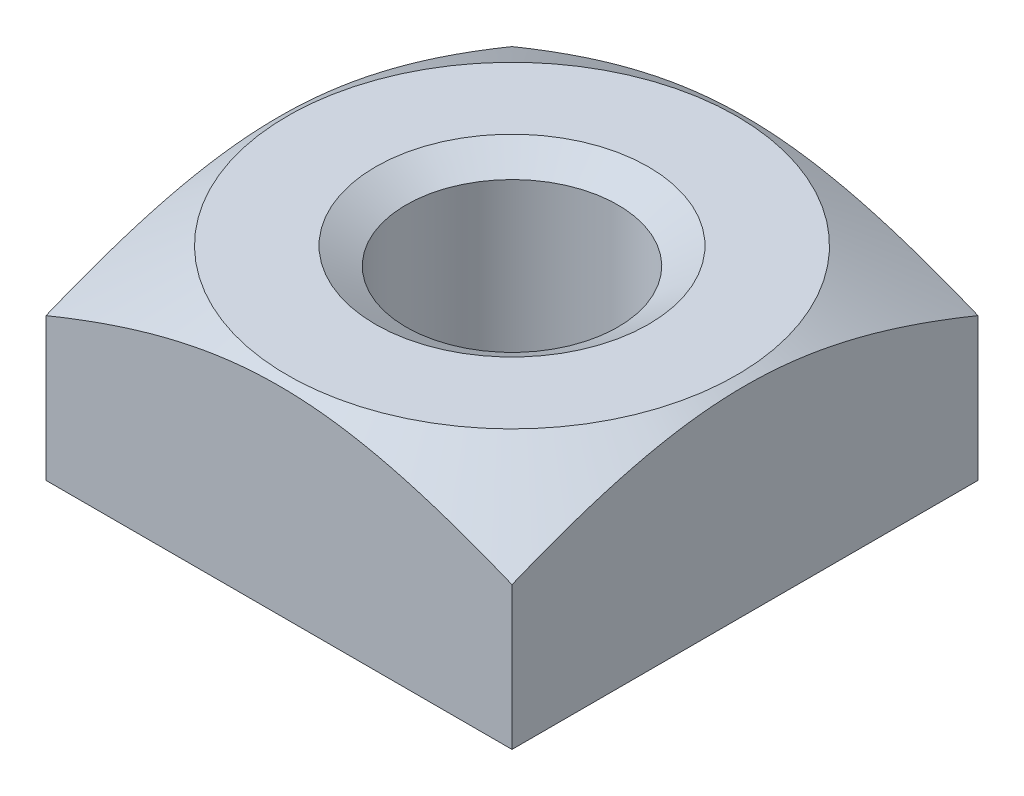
SolidWorks part; units mm, degrees
ref_plane "Front Plane" through (0, 0, 0) normal (0, 0, 1) x (1, 0, 0)
ref_plane "Top Plane" through (0, 0, 0) normal (0, 1, 0) x (1, 0, 0)
ref_plane "Right Plane" through (0, 0, 0) normal (1, 0, 0) x (0, 0, -1)
sketch "BaseNutSke" plane through (0, 0, 0) normal (0, 1, 0) x (1, 0, 0)
  line L0 (-54.4776, 0) -> (74.7044, 0) construction
  line L1 (0, 52.5898) -> (0, -71.4681) construction
  line L3 (-2.75, 2.75) -> (2.75, 2.75)
  line L4 (-2.75, 2.75) -> (-2.75, -2.75)
  line L5 (-2.75, -2.75) -> (2.75, -2.75)
  line L6 (2.75, 2.75) -> (2.75, -2.75)
  dimension "Width" = 5.5
extrude "Basenut" add sketch "BaseNutSke" along normal blind 2.4
sketch "CutNutSke" plane through (0, 0, 0) normal (0, 0, 1) x (1, 0, 0)
  line L0 (2.65, 2.4) -> (6.8069, 2.4)
  line L1 (6.8069, 2.4) -> (6.8069, 0)
  line L2 (6.8069, 0) -> (2.65, 2.4)
  line L3 (0, 0) -> (0, 5.607) construction
  line L4 (-2.75, 2.4) -> (2.75, 2.4) construction
  dimension "D1" = 30
  dimension "FaceDiameter" = 5.3
revolve "CutNut" cut sketch "CutNutSke" angle 360 about L3
sketch "HoleSke" plane through (0, 0, 0) normal (0, 1, 0) x (1, 0, 0)
  circle A0 centre (0, 0) radius 1.25
  dimension "Tap_drill" = 2.5
extrude "TappedHole" cut sketch "HoleSke" along normal through all
chamfer "Chamfer1" distance 0.2083 angle 60 2 edges at (0, 0, 1.25) (0, 2.4, 1.25)
sketch "ThdSchSke" plane through (0, 0, 0) normal (0, 0, 1) x (1, 0, 0)
  line L0 (1.5, 2.0473) -> (1.25, 2.1917)
  line L1 (1.25, 2.1917) -> (0.9613, 2.1917)
  line L2 (0.9613, 2.1917) -> (0.9613, 1.903)
  line L3 (0.9613, 1.903) -> (1.25, 1.903)
  line L4 (1.25, 1.903) -> (1.5, 2.0473)
  line L6 (1.25, 2.1917) -> (-1.25, 2.1917) construction
  line L7 (0, 0) -> (0, 3.2439) construction
  dimension "D1" = 3
  dimension "D2" = 2.5
revolve "ThreadSchematic" [suppressed] cut sketch "ThdSchSke" angle 360 about L7
pattern_linear "ThdSchPat" [suppressed] count 4 along (0, 1, 0)
equation "\"D1@Chamfer1\" = \"Tap_drill@HoleSke\"/12"
equation "\"D1@ThdSchSke\" = \"Thread_major@ThreadCosmetic\""
equation "\"D2@ThdSchSke\" = \"Tap_drill@HoleSke\""
equation "\"D1@ThdSchPat\" =  int(( \"Height@Basenut\" -\"D1@Chamfer1\"*2)/ \"ADVANCE@ThdSchPat\" ) +1"
